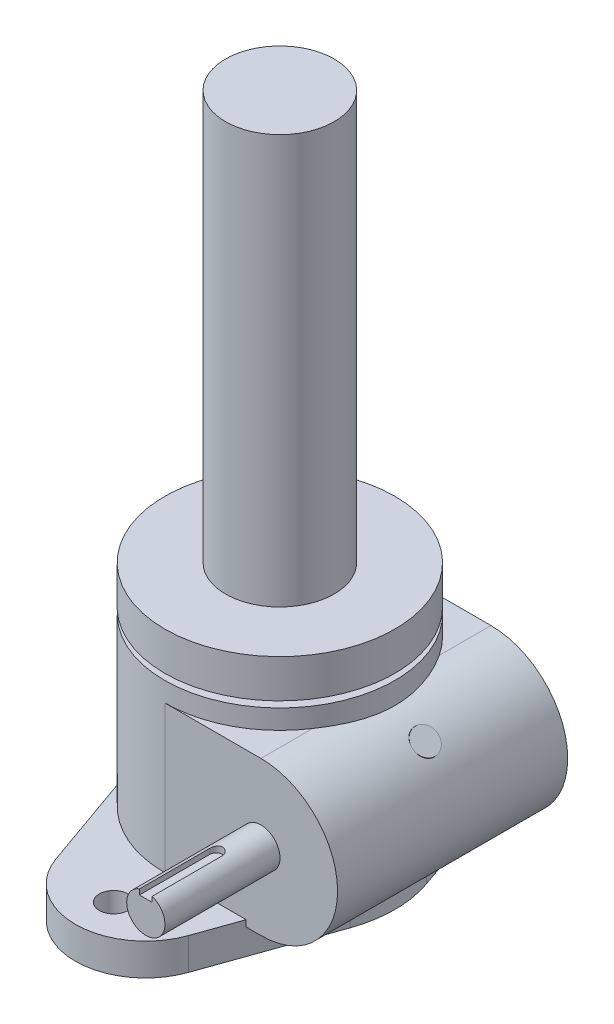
SolidWorks part; units mm, degrees
ref_plane "Front" through (0, 0, 0) normal (0, 0, 1) x (1, 0, 0)
ref_plane "Top" through (0, 0, 0) normal (0, 1, 0) x (1, 0, 0)
ref_plane "Right" through (0, 0, 0) normal (1, 0, 0) x (0, 0, -1)
ref_plane "Worm_Housing_1Limit" through (0, 0, -28.575) normal (0, 0, 1) x (1, 0, 0)
ref_plane "Worm_Housing_2Limit" through (0, 0, 28.575) normal (0, 0, 1) x (1, 0, 0)
sketch "Sketch1" plane through (0, 0, 0) normal (0, 0, 1) x (1, 0, 0)
  line L3 (0, -9.525) -> (-14.2875, -9.525) construction
  line L9 (-14.2875, -9.525) -> (-14.2875, 0) construction
  line L10 (0, 0) -> (-28.575, 0) construction
  line L11 (-28.575, 0) -> (-28.575, 49.276) construction
  line L13 (-22.987, 49.276) -> (-22.987, 50.8) construction
  line L14 (-28.575, 49.276) -> (-22.987, 49.276) construction
  line L15 (-22.987, 50.8) -> (-28.575, 50.8) construction
  line L16 (-28.575, 50.8) -> (-28.575, 60.325) construction
  line L17 (-28.575, 60.325) -> (0, 60.325) construction
  line L18 (0, 0) -> (0, 143.9633) construction
  line L19 (0, 0) -> (0, 143.9633) construction
  line L20 (-13.4938, 161.925) -> (-13.4937, 60.325) construction
  line L22 (-13.4938, 161.925) -> (0, 161.925) construction
  line L24 (0, -9.525) -> (-14.2875, -9.525)
  line L25 (-14.2875, -9.525) -> (-14.2875, 0)
  line L26 (-14.2875, 0) -> (-28.575, 0)
  line L27 (-28.575, 0) -> (-28.575, 49.276)
  line L28 (-22.987, 49.276) -> (-22.987, 50.8)
  line L29 (-28.575, 49.276) -> (-22.987, 49.276)
  line L30 (-22.987, 50.8) -> (-28.575, 50.8)
  line L31 (-28.575, 50.8) -> (-28.575, 60.325)
  line L32 (-28.575, 60.325) -> (-13.4937, 60.325)
  line L33 (-13.4938, 161.925) -> (-13.4937, 60.325)
  line L34 (-13.4938, 161.925) -> (0, 161.925)
  line L35 (0, 161.925) -> (0, -9.525)
revolve "Base-Revolve" add sketch "Sketch1" angle 360 about L19
sketch "Sketch2" plane through (0, 0, 0) normal (0, 0, 1) x (1, 0, 0)
  line L0 (0, 0) -> (0, 143.9633) construction
  line L1 (23.8633, 6.35) -> (0, 6.35) construction
  line L2 (23.8633, 44.45) -> (0, 44.45) construction
  line L4 (23.8633, 6.35) -> (0, 6.35)
  line L5 (23.8633, 44.45) -> (0, 44.45)
  line L6 (0, 44.45) -> (0, 6.35)
  arc A0 (23.8633, 6.35) -> (23.8633, 44.45) centre (23.8633, 25.4) ccw construction
  arc A1 (23.8633, 6.35) -> (23.8633, 44.45) centre (23.8633, 25.4) ccw
extrude "Boss-Extrude2" add sketch "Sketch2" along normal up to surface (28.575 mm away) and the other way up to surface (28.575 mm away)
ref_plane "Plane1" through (23.8633, 0, 0) normal (-1, 0, 0) x (0, 0, 1)
sketch "Sketch3" plane through (23.8633, 0, 0) normal (-1, 0, 0) x (0, 0, 1)
  line L0 (-105.8953, 25.4) -> (105.8953, 25.4) construction
  line L1 (-28.6004, 20.6502) -> (57.15, 20.6502)
  line L2 (-28.6004, 20.6502) -> (-28.6004, 25.4)
  line L3 (-28.6004, 25.4) -> (57.15, 25.4)
  line L4 (57.15, 20.6502) -> (57.15, 25.4)
revolve "Boss-Revolve1" add sketch "Sketch3" angle 360 about L0
ref_plane "Plane3" through (0, 28.5648, 0) normal (0, 1, 0) x (-1, 0, 0)
sketch "Sketch8" plane through (0, 28.5623, 0) normal (0, 1, 0) x (-1, 0, 0)
  line L3 (-25.4508, -28.6004) -> (-22.2758, -28.6004)
  line L4 (-25.4508, -11.1379) -> (-25.4508, -28.6004)
  line L5 (-22.2758, -28.6004) -> (-22.2758, -11.1379)
  line L6 (-25.4508, -28.6004) -> (-22.2758, -28.6004)
  line L7 (-25.4508, -11.1379) -> (-25.4508, -28.6004)
  line L8 (-22.2758, -28.6004) -> (-22.2758, -11.1379)
  arc A1 (-22.2758, -11.1379) -> (-25.4508, -11.1379) centre (-23.8633, -11.1379) ccw
  arc A2 (-22.2758, -11.1379) -> (-25.4508, -11.1379) centre (-23.8633, -11.1379) ccw
  dimension "D1" = 0
extrude "Cut-Keyway1" cut sketch "Sketch8" along normal up to surface (0.0025 mm away)
sketch "Sketch5" plane through (0, 0, 0) normal (0, 1, 0) x (-1, 0, 0)
  line L4 (26.9408, 9.525) -> (16.4638, 39.1583)
  line L5 (16.4638, -39.1583) -> (26.9408, -9.525)
  line L6 (-26.9408, -9.525) -> (-16.4638, -39.1583)
  line L7 (-16.4638, 39.1583) -> (-26.9408, 9.525)
  line L8 (26.9408, 9.525) -> (16.4638, 39.1583)
  line L9 (16.4638, -39.1583) -> (26.9408, -9.525)
  line L10 (-26.9408, -9.525) -> (-16.4638, -39.1583)
  line L11 (-16.4638, 39.1583) -> (-26.9408, 9.525)
  circle A0 centre (0, -41.275) radius 3.5719 construction
  circle A1 centre (0, -41.275) radius 3.5719
  circle A2 centre (0, 41.275) radius 3.5719 construction
  circle A3 centre (0, 41.275) radius 3.5719
  arc A4 (26.9408, -9.525) -> (26.9408, 9.525) centre (0, 0) ccw
  arc A5 (-16.4638, -39.1583) -> (16.4638, -39.1583) centre (0, -33.3375) ccw
  arc A6 (-26.9408, 9.525) -> (-26.9408, -9.525) centre (0, 0) ccw
  arc A7 (16.4638, 39.1583) -> (-16.4638, 39.1583) centre (0, 33.3375) ccw
  arc A8 (26.9408, -9.525) -> (26.9408, 9.525) centre (0, 0) ccw
  arc A9 (-16.4638, -39.1583) -> (16.4638, -39.1583) centre (0, -33.3375) ccw
  arc A10 (-26.9408, 9.525) -> (-26.9408, -9.525) centre (0, 0) ccw
  arc A11 (16.4638, 39.1583) -> (-16.4638, 39.1583) centre (0, 33.3375) ccw
  dimension "D1" = 0
ref_plane "Plane2" through (0, 7.9375, 0) normal (0, 1, 0) x (-1, 0, 0)
extrude "Boss-Extrude3" add sketch "Sketch5" along normal up to surface (7.9375 mm away)
sketch "Sketch6" plane through (0, 0, 0) normal (0, 0, 1) x (1, 0, 0)
  line L2 (0, -28.575) -> (-7.9375, -28.575) construction
  line L3 (0, 161.925) -> (0, -28.575) construction
  line L4 (0, 159.385) -> (0, -28.575)
  line L6 (-7.9375, -28.575) -> (-7.9375, 146.685) construction
  line L8 (0, 0) -> (0, 143.9633) construction
  line L9 (0, 9.525) -> (-10.9537, 9.525) construction
  line L10 (-10.9537, 60.325) -> (-10.9537, 9.525) construction
  line L11 (-10.9538, 159.385) -> (-10.9537, 60.325) construction
  line L12 (-10.9538, 159.385) -> (0, 159.385) construction
  line L15 (0, -28.575) -> (-7.9375, -28.575)
  line L16 (0, 0) -> (0, 143.9633) construction
  line L17 (-7.9375, -28.575) -> (-7.9375, 9.525)
  line L18 (-7.9375, 9.525) -> (-10.9537, 9.525)
  line L19 (-10.9537, 60.325) -> (-10.9537, 9.525)
  line L20 (-10.9538, 159.385) -> (-10.9537, 60.325)
  line L21 (-10.9538, 159.385) -> (0, 159.385)
revolve "Cut-Revolve1" cut sketch "Sketch6" angle 360 about L16
sketch "Sketch7" plane through (0, 0, 0) normal (0, 0, 1) x (1, 0, 0)
  line L0 (23.8633, 25.4) -> (49.6328, 56.1109) construction
  line L1 (23.8633, 25.4) -> (49.6328, 56.1109) construction
  line L2 (38.5406, 37.9523) -> (36.1084, 39.9931) construction
  line L3 (34.0676, 37.561) -> (36.4997, 35.5201) construction
  line L4 (36.4997, 35.5201) -> (38.5406, 37.9523) construction
  line L5 (36.1084, 39.9931) -> (34.0676, 37.561) construction
  line L6 (34.0676, 37.561) -> (36.4997, 35.5201)
  line L7 (36.4997, 35.5201) -> (38.5406, 37.9523)
  line L8 (38.5406, 37.9523) -> (36.1084, 39.9931)
  line L9 (36.1084, 39.9931) -> (34.0676, 37.561)
revolve "Boss-Revolve2" add sketch "Sketch7" angle 360 about L1
ref_plane "Plane4" through (0, 53.9623, 0) normal (0, 1, 0) x (-1, 0, 0)
sketch "Sketch10" plane through (0, 28.5623, 0) normal (0, 1, 0) x (-1, 0, 0)
  line L3 (-22.2758, 57.15) -> (-25.4508, 57.15)
  line L4 (-25.4508, 57.15) -> (-25.4508, 39.6875)
  line L5 (-22.2758, 39.6875) -> (-22.2758, 57.15)
  line L6 (-22.2758, 57.15) -> (-25.4508, 57.15)
  line L7 (-25.4508, 57.15) -> (-25.4508, 39.6875)
  line L8 (-22.2758, 39.6875) -> (-22.2758, 57.15)
  arc A1 (-25.4508, 39.6875) -> (-22.2758, 39.6875) centre (-23.8633, 39.6875) ccw
  arc A2 (-25.4508, 39.6875) -> (-22.2758, 39.6875) centre (-23.8633, 39.6875) ccw
  dimension "D1" = 0
extrude "Cut-Keyway2" cut sketch "Sketch10" along normal up to surface (25.4 mm away)
